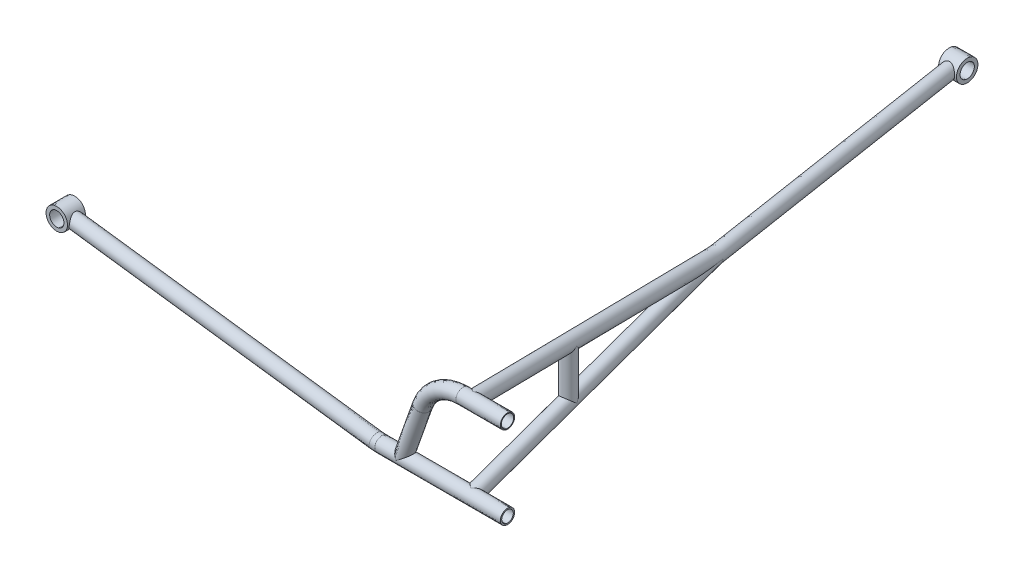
SolidWorks part; units mm, degrees
ref_plane "Front Plane" through (0, 0, 0) normal (0, 0, 1) x (1, 0, 0)
ref_plane "Top Plane" through (0, 0, 0) normal (0, 1, 0) x (1, 0, 0)
ref_plane "Right Plane" through (0, 0, 0) normal (1, 0, 0) x (0, 0, -1)
sketch "Sketch1" plane through (0, 0, 0) normal (0, 0, 1) x (1, 0, 0)
  line L0 (0, 0) -> (1081.6455, 0) construction
  line L1 (755.65, 73.025) -> (755.65, -73.025) construction
  line L2 (717.55, 73.025) -> (717.55, -73.025) construction
  line L3 (831.85, 73.025) -> (831.85, -73.025) construction
  line L4 (711.9196, 73.025) -> (831.85, 73.025) construction
  line L5 (708.3759, -73.025) -> (956.2868, -73.025) construction
  point P3 (965.2, -25.4)
  point P5 (755.65, 73.025)
  point P6 (781.05, -73.025)
  point P7 (755.65, -73.025)
  point P8 (755.65, 0)
  point P12 (781.05, 73.025)
  point P15 (831.85, 0)
  dimension "D1" = 25.4
  dimension "D2" = 965.2
  dimension "D3" = 73.025
  dimension "D4" = 73.025
  dimension "D5" = 133.35
  dimension "D6" = 50.8
  dimension "D7" = 25.4
  dimension "D8" = 38.1
sketch "Sketch2" plane through (0, 0, 0) normal (0, 0, 1) x (1, 0, 0)
  circle A0 centre (0, 0) radius 19.05
  dimension "D1" = 38.1
extrude "Boss-Extrude1" add sketch "Sketch2" along normal mid plane 31.75
sketch "Sketch3" plane through (0, 0, 0) normal (0, 1, 0) x (1, 0, 0)
  line L0 (0, 0) -> (0, 1016) construction
  line L1 (0, 1016) -> (561.975, 1016) construction
  point P3 (558.8, 1016)
  dimension "D1" = 561.975
  dimension "D2" = 1016
  dimension "D3" = 3.175
ref_plane "Plane1" through (561.975, 0, -1016) normal (1, 0, 0) x (0, 0, -1)
sketch "Sketch4" plane through (561.975, 0, -1016) normal (1, 0, 0) x (0, 0, -1)
  line L0 (-1016, 0) -> (0, 0) construction
  circle A0 centre (0, 0) radius 19.05
  dimension "D1" = 38.1
extrude "Boss-Extrude2" add sketch "Sketch4" along normal mid plane 31.75 separate body contours A0
sketch "Sketch5" plane through (0, 0, 0) normal (0, 0, 1) x (1, 0, 0)
  line L0 (781.05, -73.025) -> (559.0084, -73.025)
  line L1 (549.0504, -72.3715) -> (0, 0)
  arc A0 (549.0504, -72.3715) -> (559.0084, -73.025) centre (559.0084, 3.175) ccw
  point P7 (554.0079, -73.025)
  dimension "D2" = 76.2
  dimension "D1" = 558.8
ref_plane "Plane2" through (781.05, -73.025, 0) normal (-1, 0, 0) x (0, 0, 1)
sketch "Sketch6" plane through (781.05, -73.025, 0) normal (-1, 0, 0) x (0, 0, 1)
  circle A0 centre (0, 0) radius 12.7
  dimension "D1" = 25.4
sweep "Sweep-Thin1" add profiles "Sketch6" path "Sketch5" parameters "D1"=2.413
sketch "Sketch8" plane through (0, 0, 0) normal (0, 0, 1) x (1, 0, 0)
  line L0 (597.1084, -73.025) -> (630.7843, 22.225)
  line L1 (702.6264, 73.025) -> (781.05, 73.025)
  line L2 (711.9196, 73.025) -> (831.85, 73.025) construction
  line L3 (781.05, -73.025) -> (559.0084, -73.025) construction
  arc A0 (630.7843, 22.225) -> (702.6264, 73.025) centre (702.6264, -3.175) cw
  dimension "D1" = 76.2
  dimension "D2" = 38.1
  dimension "D3" = 95.25
ref_plane "Plane3" through (781.05, 73.025, 0) normal (1, 0, 0) x (0, 0, -1)
sketch "Sketch9" plane through (781.05, 73.025, 0) normal (1, 0, 0) x (0, 0, -1)
  circle A0 centre (0, 0) radius 12.7
  dimension "D1" = 25.4
ref_plane "Plane4" through (700.4492, 0, -109.4452) normal (0.988, 0, -0.1544) x (-0.1544, 0, -0.988)
sketch "Sketch11" plane through (700.4492, 0, -109.4452) normal (0.988, 0, -0.1544) x (-0.1544, 0, -0.988)
  line L0 (-116.6549, 0) -> (917.5544, 0) construction
  line L1 (917.5544, 0) -> (409.5544, 0)
  line L2 (398.8556, 0.7548) -> (-110.7731, 73.025)
  arc A0 (398.8556, 0.7548) -> (409.5544, 0) centre (409.5544, 76.2) ccw
  point P10 (404.1784, 0)
  dimension "D1" = 76.2
  dimension "D2" = 508
ref_plane "Plane5" through (558.8, 0, -1016) normal (0.1544, 0, 0.988) x (0.988, 0, -0.1544)
sketch "Sketch12" plane through (558.8, 0, -1016) normal (0.1544, 0, 0.988) x (0.988, 0, -0.1544)
  circle A0 centre (0, 0) radius 12.7
  dimension "D1" = 25.4
sweep "Sweep-Thin3" add profiles "Sketch12" path "Sketch11" parameters "D1"=2.413
sketch "Sketch13" plane through (700.4492, 0, -109.4452) normal (0.988, 0, -0.1544) x (-0.1544, 0, -0.988)
  line L0 (-110.7731, -73.025) -> (404.1784, 0) construction
  point P4 (146.7026, -36.5125)
ref_plane "Plane6" through (677.8017, -36.5125, -254.3891) normal (-0.1528, 0.1404, -0.9782) x (-0.9882, -0.0329, 0.1497)
sketch "Sketch14" plane through (677.8017, -36.5125, -254.3891) normal (-0.1528, 0.1404, -0.9782) x (-0.9882, -0.0329, 0.1497)
  circle A0 centre (0, 0) radius 12.7
  dimension "D1" = 25.4
extrude "Extrude-Thin1" add sketch "Sketch14" along normal up to surface and the other way up to surface thin
sketch "Sketch15" plane through (781.05, 0, 0) normal (1, 0, 0) x (0, 0, -1)
  circle A0 centre (0, -73.025) radius 10.287
  circle A2 centre (0, -73.025) radius 10.287 construction
hole_wizard "1 (1) Diameter Slot1" positions "Sketch17" profile "Sketch18" size "1" standard "ANSI Inch"
sketch "Sketch17" plane through (577.85, 0, 0) normal (1, 0, 0) x (0, 0, -1)
  point P0 (1016, 0)
sketch "Sketch18" plane through (577.85, 0, -1016) normal (0, 1, 0) x (0, 0, -1)
  line L0 (0, 0) -> (0, 596.9)
  line L1 (0, 596.9) -> (12.7, 596.9)
  line L2 (12.7, 596.9) -> (12.7, 0)
  line L5 (12.7, 0) -> (0, 0)
  line L11 (0, -6.35) -> (0, 107.95) construction
  dimension "Thru Hole Dia." = 25.4
  dimension "Thru Hole Depth" = 596.9
hole_wizard "1 (1) Diameter Slot2" positions "Sketch19" profile "Sketch20" size "1" standard "ANSI Inch"
sketch "Sketch19" plane through (0, 0, -15.875) normal (0, 0, -1) x (-1, 0, 0)
  point P0 (0, 0)
sketch "Sketch20" plane through (0, 0, -15.875) normal (1, 0, 0) x (0, 1, 0)
  line L0 (0, 0) -> (0, 31.75)
  line L1 (0, 31.75) -> (12.7, 31.75)
  line L2 (12.7, 31.75) -> (12.7, 0)
  line L5 (12.7, 0) -> (0, 0)
  line L11 (0, -6.35) -> (0, 107.95) construction
  dimension "Thru Hole Dia." = 25.4
  dimension "Thru Hole Depth" = 31.75
sweep "Sweep-Thin4" add profiles "Sketch9" path "Sketch8" parameters "D1"=1.651
sketch "Sketch21" plane through (781.05, 0, 0) normal (1, 0, 0) x (0, 0, -1)
  circle A0 centre (0, 73.025) radius 11.049
  circle A1 centre (0, 73.025) radius 11.049 construction
extrude "Cut-Extrude1" cut sketch "Sketch21" against normal up to next
sketch "Sketch22" plane through (0, 0, 0) normal (0, 1, 0) x (1, 0, 0)
  line L0 (718.458, -5.8112) -> (558.8, 1016) construction
  line L1 (708.3759, 0) -> (956.2868, 0) construction
  circle A0 centre (685.8, 203.2) radius 12.7
  dimension "D1" = 25.4
  dimension "D2" = 203.2
extrude "Extrude-Thin2" add sketch "Sketch22" along normal up to surface and the other way up to surface thin
sketch "Sketch23" plane through (700.4492, 0, -109.4452) normal (0.988, 0, -0.1544) x (-0.1544, 0, -0.988)
  line L0 (94.8924, 0) -> (94.8924, 81.9597) construction
  line L1 (0, 0) -> (1003.8202, 0) construction
  line L2 (94.8924, 43.8597) -> (94.8924, -43.8597) construction
  line L3 (398.8556, 0.7548) -> (-110.7731, 73.025) construction
  point P6 (94.8924, 43.8597)
  point P7 (94.8924, 81.9597)
  dimension "D1" = 38.1
